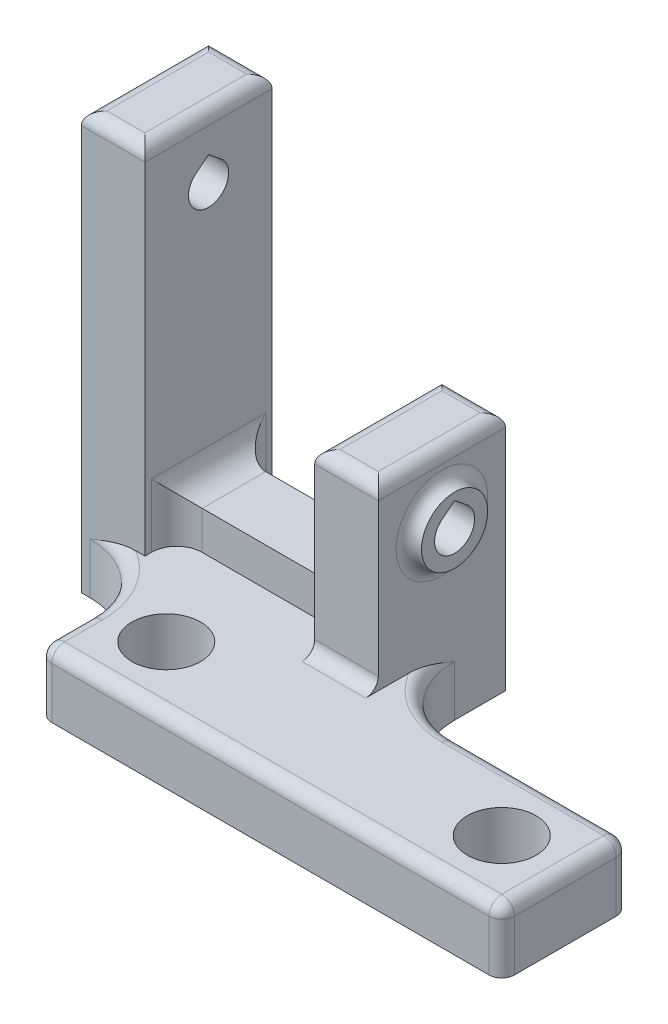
SolidWorks part; units mm, degrees
other "Markup1"
sketch "Sketch8" plane through (-17.3667, 38.5115, 25.4) normal (-0.0434, 0.6708, 0.7404) x (0.9991, 0.0264, 0.0346)
sketch "Sketch9" plane through (-17.3667, 38.5115, 25.4) normal (-0.0434, 0.6708, 0.7404) x (0.9991, 0.0264, 0.0346)
sketch "Sketch10" plane through (-17.3667, 38.5115, 25.4) normal (-0.0434, 0.6708, 0.7404) x (0.9991, 0.0264, 0.0346)
sketch "Sketch15" plane through (-16.0967, 38.5115, 25.4) normal (-0.0434, 0.6708, 0.7404) x (0.9991, 0.0264, 0.0346)
ref_plane "Front Plane" through (0, 0, 0) normal (0, 0, 1) x (1, 0, 0)
ref_plane "Top Plane" through (0, 0, 0) normal (0, 1, 0) x (1, 0, 0)
ref_plane "Right Plane" through (0, 0, 0) normal (1, 0, 0) x (0, 0, -1)
sketch "Sketch1" plane through (0, 0, 0) normal (0, 0, 1) x (1, 0, 0)
  line L1 (8.4767, 3.175) -> (-8.4767, 3.175)
  line L2 (8.4767, 3.175) -> (8.4767, -3.175)
  line L3 (8.4767, -3.175) -> (-8.4767, -3.175)
  line L4 (-8.4767, 3.175) -> (-8.4767, -3.175)
  line L5 (8.4767, 3.175) -> (-8.4767, -3.175) construction
  line L6 (8.4767, -3.175) -> (-8.4767, 3.175) construction
  line L7 (-8.4767, -3.175) -> (-14.8267, -3.175)
  line L8 (-8.4767, -3.175) -> (-8.4767, 38.5115)
  line L9 (-8.4767, 38.5115) -> (-14.8267, 38.5115)
  line L10 (-14.8267, -3.175) -> (-14.8267, 38.5115)
  line L11 (8.4767, -3.175) -> (14.8267, -3.175)
  line L12 (8.4767, -3.175) -> (8.4767, 20.8737)
  line L13 (8.4767, 20.8737) -> (14.8267, 20.8737)
  line L14 (14.8267, -3.175) -> (14.8267, 20.8737)
  line L15 (14.8267, -3.175) -> (31.0827, -3.175)
  line L16 (14.8267, -3.175) -> (14.8267, 3.175)
  line L17 (14.8267, 3.175) -> (31.0827, 3.175)
  line L18 (31.0827, -3.175) -> (31.0827, 3.175)
  line L19 (-14.8267, -3.175) -> (-31.0827, -3.175)
  line L20 (-14.8267, -3.175) -> (-14.8267, 3.175)
  line L21 (-14.8267, 3.175) -> (-31.0827, 3.175)
  line L22 (-31.0827, -3.175) -> (-31.0827, 3.175)
  point P0 (0, 0)
  dimension "D1" = 6.35
  dimension "D2" = 6.35
  dimension "D3" = 29.6534
  dimension "D4" = 24.0487
  dimension "D5" = 16.256
  dimension "D6" = 17.6378
extrude "Boss-Extrude1" add sketch "Sketch1" along normal blind 12.7 contours L1 L4 L3 L2 | L10 L7 L4 L8 L9 | L11 L14 L13 L12 L2 | L22 L19 L10 L21 | L15 L18 L17 L14
sketch "Sketch2" plane through (14.8267, 0, 0) normal (1, 0, 0) x (0, 0, -1)
  line L0 (-12.7, 20.8737) -> (0, 20.8737) construction
  line L1 (-12.7, 19.1214) -> (0, 19.1214) construction
  line L2 (-12.7, 3.175) -> (-12.7, 20.8737) construction
  line L3 (0, 3.175) -> (0, 20.8737) construction
  circle A0 centre (-6.35, 14.5237) radius 2
  point P10 (-6.35, 19.1214)
  dimension "D2" = 4
  dimension "D1" = 6.35
extrude "Cut-Extrude1" cut sketch "Sketch2" against normal up to next
sketch "Sketch3" plane through (0, 3.175, 0) normal (0, 1, 0) x (1, 0, 0)
  line L0 (-25.4, -6.35) -> (25.4, -6.35) construction
  line L3 (-2.1285, 0) -> (-2.1285, -12.7) construction
  line L6 (8.4767, 0) -> (-8.4767, 0) construction
  line L7 (8.4767, -12.7) -> (-8.4767, -12.7) construction
  circle A0 centre (-25.4, -6.35) radius 3.175
  circle A1 centre (25.4, -6.35) radius 3.175
  point P0 (0, -6.35)
  point P7 (-2.1285, -6.35)
  dimension "D1" = 6.35
  dimension "D2" = 50.8
extrude "Cut-Extrude2" cut sketch "Sketch3" against normal up to next
sketch "Sketch4" plane through (-14.8267, 0, 0) normal (-1, 0, 0) x (0, 0, 1)
  line L0 (0, 36.4885) -> (12.7, 36.4885) construction
  line L1 (0, 3.175) -> (0, 38.5115) construction
  line L2 (12.7, 3.175) -> (12.7, 38.5115) construction
  line L3 (12.7, 38.5115) -> (0, 38.5115) construction
  circle A0 centre (6.35, 32.1615) radius 2
  point P9 (6.35, 36.4885)
  dimension "D2" = 4
  dimension "D1" = 6.35
extrude "Cut-Extrude3" cut sketch "Sketch4" against normal up to next
sketch "Sketch5" plane through (0, 3.175, 0) normal (0, 1, 0) x (1, 0, 0)
  line L0 (8.4767, 0) -> (-8.4767, 0) construction
  line L1 (-6.35, 0) -> (6.35, 0)
  line L2 (-6.35, 0) -> (-6.35, 12.7)
  line L3 (-6.35, 12.7) -> (6.35, 12.7)
  line L4 (6.35, 0) -> (6.35, 12.7)
  line L5 (8.4767, -12.7) -> (-8.4767, -12.7) construction
  line L6 (-6.35, -12.7) -> (6.35, -12.7)
  line L7 (-6.35, -12.7) -> (-6.35, -25.4)
  line L8 (-6.35, -25.4) -> (6.35, -25.4)
  line L9 (6.35, -12.7) -> (6.35, -25.4)
  circle A0 centre (0, 6.35) radius 3.429
  circle A1 centre (0, -19.05) radius 3.429
  point P16 (0, 12.7)
  point P20 (-6.35, 6.35)
  point P22 (-6.35, -19.05)
  point P24 (0, -12.7)
  dimension "D1" = 6.858
  dimension "D2" = 12.7
  dimension "D3" = 12.7
extrude "Boss-Extrude2" add sketch "Sketch5" against normal up to surface (6.35 mm away)
sketch "Sketch6" plane through (0, 3.175, 0) normal (0, 1, 0) x (1, 0, 0)
  line L0 (14.8267, -12.7) -> (14.8267, 0) construction
  line L1 (-14.8267, 2.5418) -> (-39.8374, 2.5418)
  line L2 (-14.8267, 2.5418) -> (-14.8267, -18.8261)
  line L3 (-14.8267, -18.8261) -> (-39.8374, -18.8261)
  line L4 (-39.8374, 2.5418) -> (-39.8374, -18.8261)
  line L5 (14.8267, 4.3339) -> (36.5977, 4.3339)
  line L6 (14.8267, 4.3339) -> (14.8267, -23.7889)
  line L7 (14.8267, -23.7889) -> (36.5977, -23.7889)
  line L8 (36.5977, 4.3339) -> (36.5977, -23.7889)
  line L9 (-14.8267, -12.7) -> (-14.8267, 0) construction
extrude "Cut-Extrude4" cut sketch "Sketch6" against normal up to surface (6.35 mm away)
sketch "Sketch7" plane through (0, 3.175, 0) normal (0, 1, 0) x (1, 0, 0)
  line L0 (-8.4767, -12.7) -> (-8.4767, 0) construction
  line L1 (-8.4767, -3.175) -> (8.4767, -3.175)
  line L2 (-8.4767, -3.175) -> (-8.4767, -9.525)
  line L3 (-8.4767, -9.525) -> (8.4767, -9.525)
  line L4 (8.4767, -3.175) -> (8.4767, -9.525)
  line L5 (8.4767, -12.7) -> (8.4767, 0) construction
  line L6 (14.8267, -12.7) -> (14.8267, 0) construction
  point P10 (14.8267, -6.35)
  point P11 (8.4767, -6.35)
  dimension "D1" = 6.35
extrude "Boss-Extrude3" add sketch "Sketch7" along normal blind 3.81
fillet "Fillet1" radius 2.54 6 edges at (8.4767, 5.08, 3.175) (8.4767, 5.08, 9.525) (8.4767, 6.985, 6.35) (-8.4767, 5.08, 3.175) (-8.4767, 5.08, 9.525) (-8.4767, 6.985, 6.35)
sketch "Sketch11" plane through (14.8267, 0, 0) normal (1, 0, 0) x (0, 0, -1)
  circle A0 centre (-6.35, 14.5237) radius 3.302
  circle A1 centre (-6.35, 14.5237) radius 2
  circle A2 centre (-6.35, 14.5237) radius 2 construction
  dimension "D1" = 6.604
extrude "Boss-Extrude4" add sketch "Sketch11" along normal blind 1.27
sketch "Sketch12" plane through (-14.8267, 0, 0) normal (-1, 0, 0) x (0, 0, 1)
  circle A0 centre (6.35, 32.1615) radius 3.302
  circle A1 centre (6.35, 32.1615) radius 2
  circle A2 centre (6.35, 32.1615) radius 2 construction
  dimension "D1" = 6.604
extrude "Boss-Extrude5" add sketch "Sketch12" along normal blind 1.27
sketch "Sketch13" plane through (-8.4767, 0, 0) normal (1, 0, 0) x (0, 0, -1)
  line L0 (-6.35, 34.723) -> (-5.1004, 33.723)
  line L1 (-5.1004, 33.723) -> (-7.5996, 33.723)
  line L2 (-7.5996, 33.723) -> (-6.35, 34.723)
  circle A0 centre (-6.35, 32.1615) radius 2 construction
  point P3 (-6.35, 33.723)
  dimension "D1" = 1
extrude "Cut-Extrude5" cut sketch "Sketch13" against normal up to surface (7.62 mm away)
sketch "Sketch14" plane through (8.4767, 0, 0) normal (-1, 0, 0) x (0, 0, 1)
  line L0 (5.1004, 16.0853) -> (6.35, 17.0853)
  line L1 (6.35, 17.0853) -> (7.5996, 16.0853)
  line L2 (7.5996, 16.0853) -> (5.1004, 16.0853)
  circle A0 centre (6.35, 14.5237) radius 2 construction
  point P7 (6.35, 16.0853)
  dimension "D1" = 1
extrude "Cut-Extrude6" cut sketch "Sketch14" against normal up to surface (7.62 mm away)
fillet "Fillet4" radius 1.27 8 edges at (-8.4767, 38.5115, 6.35) (-11.6517, 38.5115, 0) (-11.6517, 38.5115, 12.7) (-14.8267, 38.5115, 6.35) (14.8267, 20.8737, 6.35) (11.6517, 20.8737, 0) (11.6517, 20.8737, 12.7) (8.4767, 20.8737, 6.35)
fillet "Fillet7" radius 1.27 2 edges at (-14.8267, 32.1615, 9.652) (14.8267, 14.5237, 9.652)
sketch "Sketch16" plane through (0, 3.175, 0) normal (0, 1, 0) x (1, 0, 0)
  line L0 (-6.35, -25.4) -> (6.35, -25.4) construction
  line L1 (6.35, -12.7) -> (39.8556, -12.7)
  line L2 (6.35, -12.7) -> (6.35, -25.4)
  line L3 (6.35, -25.4) -> (39.8556, -25.4)
  line L4 (39.8556, -12.7) -> (39.8556, -25.4)
  circle A0 centre (33.5056, -19.05) radius 3.429
  circle A1 centre (0, -19.05) radius 3.429 construction
  point P11 (0, 0)
  point P12 (39.8556, -19.05)
  dimension "D1" = 33.5056
  dimension "D2" = 6.35
extrude "Boss-Extrude6" add sketch "Sketch16" against normal up to surface (6.35 mm away)
sketch "Sketch17" plane through (0, 3.175, 0) normal (0, 1, 0) x (1, 0, 0)
  line L0 (8.4767, 0) -> (6.35, 0) construction
  line L1 (-15.3058, 16.3044) -> (24.5545, 16.3044)
  line L2 (-15.3058, 16.3044) -> (-15.3058, 0)
  line L3 (-15.3058, 0) -> (24.5545, 0)
  line L4 (24.5545, 16.3044) -> (24.5545, 0)
  point P4 (24.5545, 2.0809)
extrude "Cut-Extrude7" cut sketch "Sketch17" against normal through all
fillet "Fillet8" radius 7.62 2 edges at (14.8267, 0, 12.7) (-6.35, 0, 12.7)
fillet "Fillet9" radius 1.27 8 edges at (39.8556, 0, 12.7) (39.8556, 0, 25.4) (39.8556, 3.175, 19.05) (-6.35, 3.175, 22.86) (17.0585, 3.175, 10.4682) (-8.5818, 3.175, 14.9318) (-6.35, 0, 25.4) (16.7528, 3.175, 25.4)
